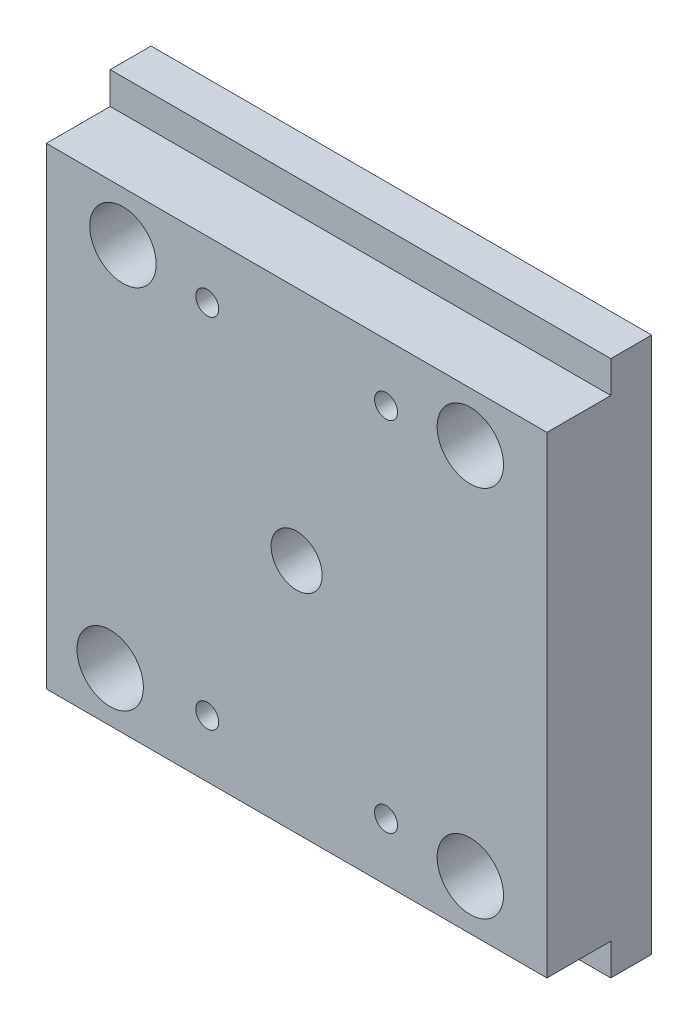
SolidWorks part; units mm, degrees
ref_plane "Plan de face" through (0, 0, 0) normal (0, 0, 1) x (1, 0, 0)
ref_plane "Plan de dessus" through (0, 0, 0) normal (0, 1, 0) x (1, 0, 0)
ref_plane "Plan de droite" through (0, 0, 0) normal (1, 0, 0) x (0, 0, -1)
sketch "Esquisse1" plane through (0, 0, 0) normal (0, 0, 1) x (1, 0, 0)
  line L1 (0, 0) -> (196, 0)
  line L2 (0, 0) -> (0, 210)
  line L3 (0, 210) -> (196, 210)
  line L4 (196, 0) -> (196, 210)
  dimension "D1" = 210
  dimension "D2" = 196
extrude "Extrusion1" add sketch "Esquisse1" along normal blind 16
sketch "Esquisse2" plane through (0, 0, 16) normal (0, 0, 1) x (1, 0, 0)
  line L0 (0, 210) -> (0, 0) construction
  line L1 (0, 197.5) -> (196, 197.5)
  line L2 (0, 197.5) -> (0, 12.5)
  line L3 (0, 12.5) -> (196, 12.5)
  line L4 (196, 197.5) -> (196, 12.5)
  line L5 (196, 0) -> (196, 210) construction
  line L7 (196, 210) -> (0, 210) construction
  dimension "D1" = 185
  dimension "D2" = 12.5
extrude "Extrusion2" add sketch "Esquisse2" along normal blind 25
sketch "Esquisse3" plane through (0, 0, 0) normal (0, 0, -1) x (-1, 0, 0)
  line L0 (-98, 210) -> (-98, 0) construction
  line L1 (-196, 210) -> (0, 210) construction
  line L2 (0, 0) -> (-196, 0) construction
  line L3 (-196, 105) -> (0, 105) construction
  line L4 (-196, 0) -> (-196, 210) construction
  line L5 (0, 210) -> (0, 0) construction
  line L6 (-214.75, 178) -> (45.0645, 178) construction
  line L7 (-218.7232, 32) -> (22.112, 32) construction
  line L8 (-166, 220.8332) -> (-166, -13.5838) construction
  line L9 (-30, 217.4713) -> (-30, -13.5838) construction
  line L10 (-25, 58.141) -> (-25, 3.3602) construction
  circle A0 centre (-30, 178) radius 13
  circle A1 centre (-166, 178) radius 13
  circle A2 centre (-166, 32) radius 13
  circle A3 centre (-25, 32) radius 13
  circle A8 centre (-98, 105) radius 10
  dimension "D18" = 20
  dimension "D19" = 26
  dimension "D20" = 26
  dimension "D21" = 26
  dimension "D22" = 26
  dimension "D1" = 73
  dimension "D2" = 73
  dimension "D3" = 68
  dimension "D4" = 68
  dimension "D5" = 73
extrude "Enlèv. mat.-Extru.1" cut sketch "Esquisse3" against normal through all
hole_wizard "Chambrage pour vis à tête hexagonale M81" positions "Esquisse6" profile "Esquisse5" counterbore size "M8" standard "ISO"
sketch "Esquisse6" plane through (0, 0, 0) normal (0, 0, -1) x (-1, 0, 0)
  line L0 (0, 105) -> (-196, 105) construction
  line L1 (0, 210) -> (0, 0) construction
  line L2 (-196, 0) -> (-196, 210) construction
  line L3 (-98, 210) -> (-98, 0) construction
  line L4 (-196, 210) -> (0, 210) construction
  line L5 (0, 0) -> (-196, 0) construction
  point P0 (-63, 35)
  point P13 (-133, 35)
  point P14 (-133, 175)
  point P15 (-63, 175)
  dimension "D1" = 70
  dimension "D2" = 35
sketch "Esquisse5" plane through (63, 35, 0) normal (1, 0, 0) x (0, 1, 0)
  line L0 (0, 0) -> (0, 41)
  line L1 (0, 41) -> (4.5, 41)
  line L3 (4.5, 41) -> (4.5, 8)
  line L4 (4.5, 8) -> (7.5, 8)
  line L5 (7.5, 8) -> (7.5, 0)
  line L7 (7.5, 0) -> (0, 0)
  line L11 (0, -6.35) -> (0, 107.95) construction
  dimension "Diamètre du perçage jusqu'au prochain" = 9
  dimension "Profondeur du perçage jusqu'au prochain" = 41
  dimension "Diamètre du chambrage" = 15
  dimension "Profondeur du chambrage" = 8
